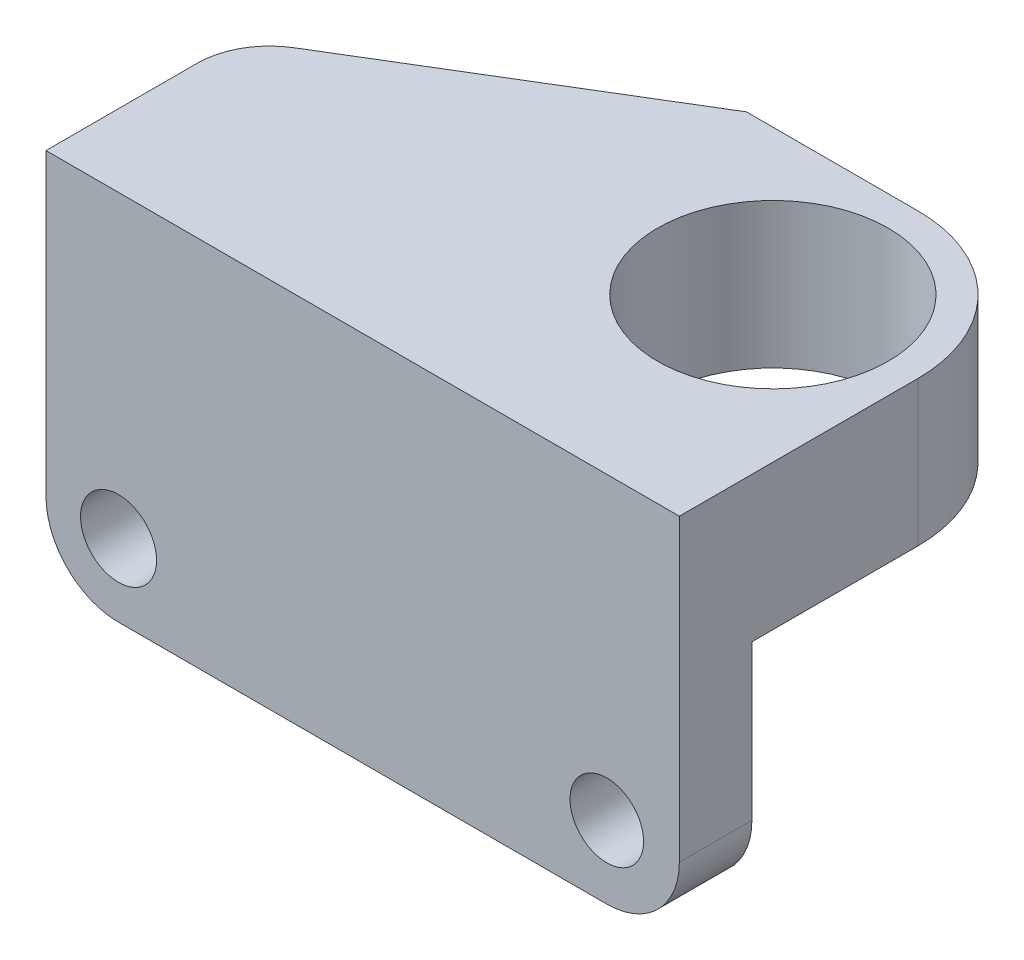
SolidWorks part; units mm, degrees
ref_plane "Alzado" through (0, 0, 0) normal (0, 0, 1) x (1, 0, 0)
ref_plane "Planta" through (0, 0, 0) normal (0, 1, 0) x (1, 0, 0)
ref_plane "Vista lateral" through (0, 0, 0) normal (1, 0, 0) x (0, 0, -1)
sketch "Croquis1" plane through (0, 0, 0) normal (0, 0, 1) x (1, 0, 0)
  line L1 (0, 0) -> (87.3073, 0)
  line L2 (0, 0) -> (0, 51.3113)
  line L3 (0, 51.3113) -> (87.3073, 51.3113)
  line L4 (87.3073, 0) -> (87.3073, 51.3113)
extrude "Extruir1" add sketch "Croquis1" along normal blind 10
sketch "Croquis2" plane through (0, 0, 10) normal (0, 0, 1) x (1, 0, 0)
  line L0 (0, 51.3113) -> (0, 0) construction
  line L1 (0, 0) -> (87.3073, 0) construction
  line L2 (87.3073, 0) -> (87.3073, 51.3113) construction
  circle A0 centre (10, 10) radius 5.2395
  circle A1 centre (77.3073, 10) radius 5.0718
  dimension "D1" = 10
  dimension "D2" = 10
  dimension "D3" = 10
  dimension "D4" = 10
extrude "Extruir2" cut sketch "Croquis2" against normal blind 10
fillet "Redondeo1" radius 10 2 edges at (0, 0, 5) (87.3073, 0, 5)
sketch "Croquis3" plane through (0, 51.3113, 0) normal (0, 1, 0) x (1, 0, 0)
  line L0 (43.6536, 42.8935) -> (0, 16.4468)
  line L1 (87.3073, -10) -> (0, -10)
  line L2 (87.3073, -10) -> (87.3073, 42.8935)
  line L3 (87.3073, 42.8935) -> (43.6536, 42.8935)
  line L4 (0, -10) -> (0, 16.4468)
extrude "Extruir3" add sketch "Croquis3" against normal blind 10
fillet "Redondeo2" radius 20 1 edges at (87.3073, 46.3113, -42.8935)
fillet "Redondeo3" radius 10 1 edges at (0, 46.3113, -16.4468)
sketch "Croquis4" plane through (0, 41.3113, 0) normal (0, -1, 0) x (1, 0, 0)
  circle A0 centre (67.3073, -22.8935) radius 20
extrude "Extruir4" add sketch "Croquis4" along normal blind 10
sketch "Croquis6" plane through (0, 31.3113, 0) normal (0, -1, 0) x (1, 0, 0)
  line L0 (87.3073, -22.8935) -> (87.3073, 0)
  line L1 (87.3073, 0) -> (47.3073, 0)
  line L2 (10, 0) -> (77.3073, 0) construction
  line L3 (47.3073, 0) -> (47.3073, -22.8935)
  line L4 (47.3073, -22.8935) -> (87.3073, -22.8935)
  circle A0 centre (67.3073, -22.8935) radius 20 construction
  arc A1 (87.3073, -22.8935) -> (67.3073, -42.8935) centre (67.3073, -22.8935) ccw construction
extrude "Extruir5" add sketch "Croquis6" against normal up to surface (10 mm away)
sketch "Croquis7" plane through (0, 31.3113, 0) normal (0, -1, 0) x (1, 0, 0)
  circle A0 centre (67.3073, -22.8935) radius 15.9054
extrude "Extruir6" cut sketch "Croquis7" against normal blind 70
